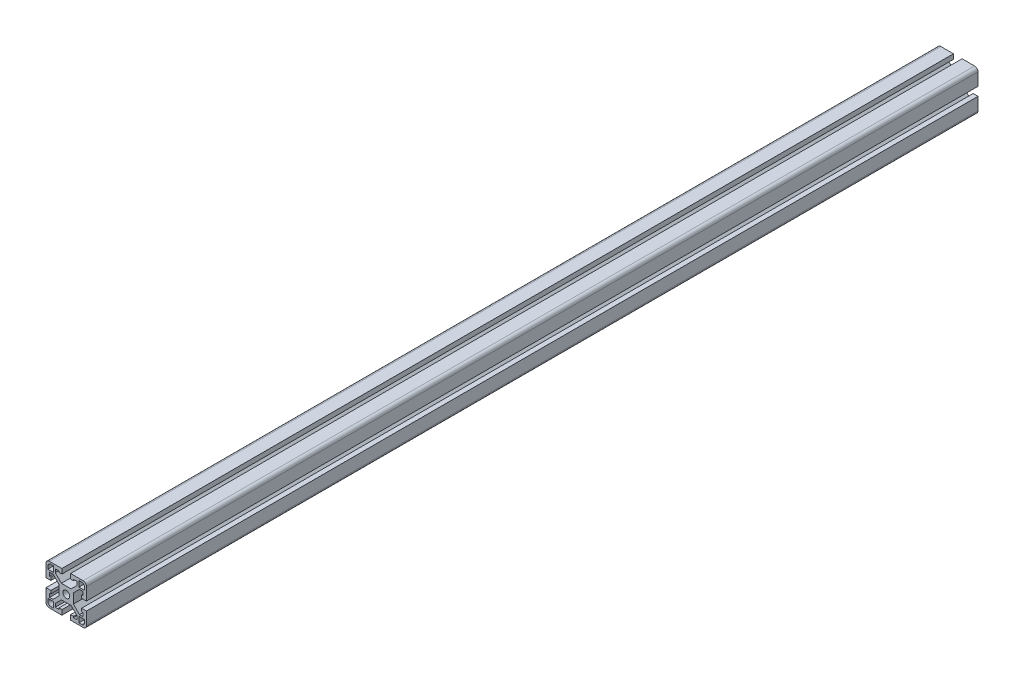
SolidWorks part; units mm, degrees
ref_plane "Front" through (0, 0, 0) normal (0, 0, 1) x (1, 0, 0)
ref_plane "Top" through (0, 0, 0) normal (0, 1, 0) x (1, 0, 0)
ref_plane "Right" through (0, 0, 0) normal (1, 0, 0) x (0, 0, -1)
sketch "Sketch1" plane through (0, 0, 0) normal (0, 0, 1) x (1, 0, 0)
  line L0 (-11.8872, 17.272) -> (-14.478, 17.272)
  line L1 (-11.8872, 11.8872) -> (-11.8872, 17.272)
  line L2 (-17.272, 11.8872) -> (-11.8872, 11.8872)
  line L3 (-17.272, 14.478) -> (-17.272, 11.8872)
  line L4 (14.478, 17.272) -> (11.8872, 17.272)
  line L5 (17.272, 11.8872) -> (17.272, 14.478)
  line L6 (11.8872, 11.8872) -> (17.272, 11.8872)
  line L7 (11.8872, 17.272) -> (11.8872, 11.8872)
  line L8 (11.8872, -17.272) -> (14.478, -17.272)
  line L9 (11.8872, -11.8872) -> (11.8872, -17.272)
  line L10 (17.272, -11.8872) -> (11.8872, -11.8872)
  line L11 (17.272, -14.478) -> (17.272, -11.8872)
  line L12 (-14.478, -17.272) -> (-11.8872, -17.272)
  line L13 (-17.272, -11.8872) -> (-17.272, -14.478)
  line L14 (-11.8872, -11.8872) -> (-17.272, -11.8872)
  line L15 (-11.8872, -17.272) -> (-11.8872, -11.8872)
  line L16 (-6.731, 4.5757) -> (-6.731, -4.5757)
  line L17 (-6.731, -4.5757) -> (-12.4423, -10.287)
  line L18 (-12.4423, -10.287) -> (-15.6718, -10.287)
  line L19 (-15.6718, -10.287) -> (-15.6718, -6.858)
  line L20 (-15.6718, -6.858) -> (-14.478, -6.858)
  line L21 (-14.478, -6.858) -> (-14.478, -4.064)
  line L22 (-14.478, -4.064) -> (-19.05, -4.064)
  line L23 (-19.05, -4.064) -> (-19.05, -15.875)
  line L24 (-15.875, -19.05) -> (-4.064, -19.05)
  line L25 (-4.064, -19.05) -> (-4.064, -14.478)
  line L26 (-4.064, -14.478) -> (-6.858, -14.478)
  line L27 (-6.858, -14.478) -> (-6.858, -15.6718)
  line L28 (-6.858, -15.6718) -> (-10.287, -15.6718)
  line L29 (-10.287, -15.6718) -> (-10.287, -12.4423)
  line L30 (-10.287, -12.4423) -> (-4.5757, -6.731)
  line L31 (-4.5757, -6.731) -> (4.5757, -6.731)
  line L32 (4.5757, -6.731) -> (10.287, -12.4423)
  line L33 (10.287, -12.4423) -> (10.287, -15.6718)
  line L34 (10.287, -15.6718) -> (6.858, -15.6718)
  line L35 (6.858, -15.6718) -> (6.858, -14.478)
  line L36 (6.858, -14.478) -> (4.064, -14.478)
  line L37 (4.064, -14.478) -> (4.064, -19.05)
  line L38 (4.064, -19.05) -> (15.875, -19.05)
  line L39 (19.05, -15.875) -> (19.05, -4.064)
  line L40 (19.05, -4.064) -> (14.478, -4.064)
  line L41 (14.478, -4.064) -> (14.478, -6.858)
  line L42 (14.478, -6.858) -> (15.6718, -6.858)
  line L43 (15.6718, -6.858) -> (15.6718, -10.287)
  line L44 (15.6718, -10.287) -> (12.4423, -10.287)
  line L45 (12.4423, -10.287) -> (6.731, -4.5757)
  line L46 (6.731, -4.5757) -> (6.731, 4.5757)
  line L47 (6.731, 4.5757) -> (12.4423, 10.287)
  line L48 (12.4423, 10.287) -> (15.6718, 10.287)
  line L49 (15.6718, 10.287) -> (15.6718, 6.858)
  line L50 (15.6718, 6.858) -> (14.478, 6.858)
  line L51 (14.478, 6.858) -> (14.478, 4.064)
  line L52 (14.478, 4.064) -> (19.05, 4.064)
  line L53 (19.05, 4.064) -> (19.05, 15.875)
  line L54 (15.875, 19.05) -> (4.064, 19.05)
  line L55 (4.064, 19.05) -> (4.064, 14.478)
  line L56 (4.064, 14.478) -> (6.858, 14.478)
  line L57 (6.858, 14.478) -> (6.858, 15.6718)
  line L58 (6.858, 15.6718) -> (10.287, 15.6718)
  line L59 (10.287, 15.6718) -> (10.287, 12.4423)
  line L60 (10.287, 12.4423) -> (4.5757, 6.731)
  line L61 (4.5757, 6.731) -> (-4.5757, 6.731)
  line L62 (-4.5757, 6.731) -> (-10.287, 12.4423)
  line L63 (-10.287, 12.4423) -> (-10.287, 15.6718)
  line L64 (-10.287, 15.6718) -> (-6.858, 15.6718)
  line L65 (-6.858, 15.6718) -> (-6.858, 14.478)
  line L66 (-6.858, 14.478) -> (-4.064, 14.478)
  line L67 (-4.064, 14.478) -> (-4.064, 19.05)
  line L68 (-4.064, 19.05) -> (-15.875, 19.05)
  line L69 (-19.05, 15.875) -> (-19.05, 4.064)
  line L70 (-19.05, 4.064) -> (-14.478, 4.064)
  line L71 (-14.478, 4.064) -> (-14.478, 6.858)
  line L72 (-14.478, 6.858) -> (-15.6718, 6.858)
  line L73 (-15.6718, 6.858) -> (-15.6718, 10.287)
  line L74 (-15.6718, 10.287) -> (-12.4423, 10.287)
  line L75 (-12.4423, 10.287) -> (-6.731, 4.5757)
  circle A0 centre (0, 0) radius 3.2639
  arc A1 (-19.05, -15.875) -> (-15.875, -19.05) centre (-15.875, -15.875) ccw
  arc A2 (15.875, -19.05) -> (19.05, -15.875) centre (15.875, -15.875) ccw
  arc A3 (19.05, 15.875) -> (15.875, 19.05) centre (15.875, 15.875) ccw
  arc A4 (-15.875, 19.05) -> (-19.05, 15.875) centre (-15.875, 15.875) ccw
  arc A5 (-14.478, 17.272) -> (-17.272, 14.478) centre (-14.478, 14.478) ccw
  arc A6 (17.272, 14.478) -> (14.478, 17.272) centre (14.478, 14.478) ccw
  arc A7 (14.478, -17.272) -> (17.272, -14.478) centre (14.478, -14.478) ccw
  arc A8 (-17.272, -14.478) -> (-14.478, -17.272) centre (-14.478, -14.478) ccw
extrude "Boss-Extrude1" add sketch "Sketch1" against normal up to surface (839.089 mm away)
